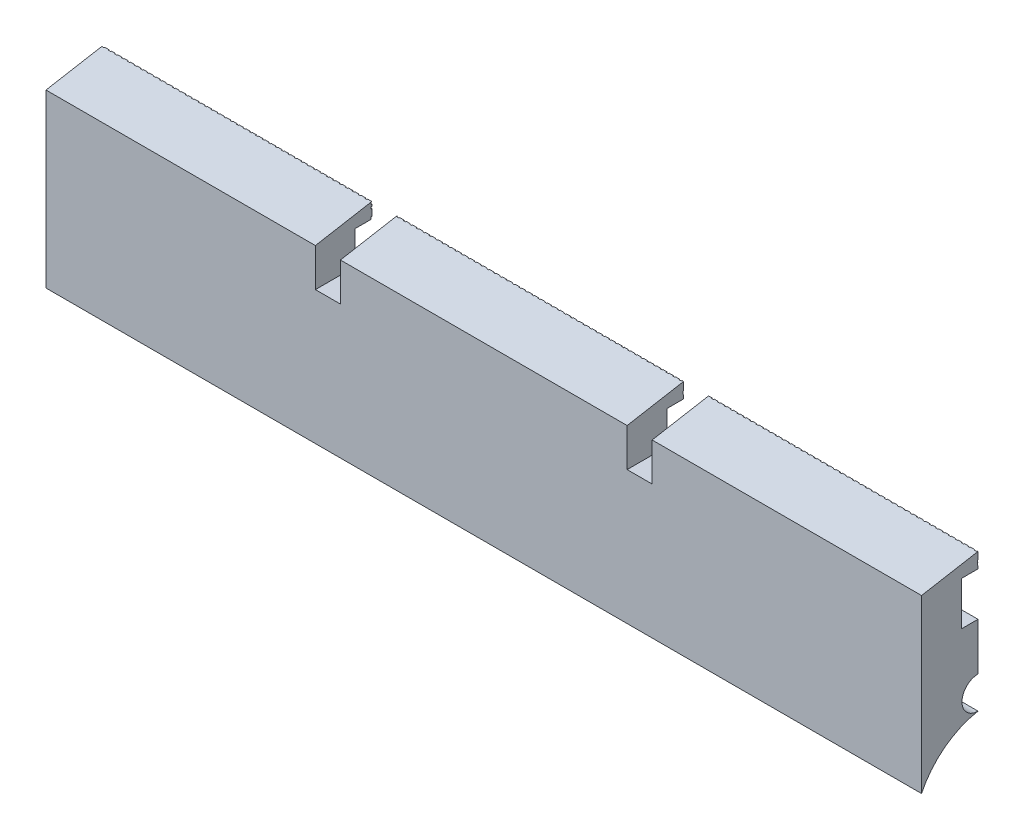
SolidWorks part; units mm, degrees
ref_plane "Plan de face" through (0, 0, 0) normal (0, 0, 1) x (1, 0, 0)
ref_plane "Plan de dessus" through (0, 0, 0) normal (0, 1, 0) x (1, 0, 0)
ref_plane "Plan de droite" through (0, 0, 0) normal (1, 0, 0) x (0, 0, -1)
imported_body "Importée1"
sketch "Esquisse1" plane through (-68.25, 0, 0) normal (-1, 0, 0) x (0, 0, 1)
  line L1 (0, 19.9908) -> (2.6, 19.9908)
  line L2 (0, 19.9908) -> (0, 13.1908)
  line L3 (0, 13.1908) -> (2.6, 13.1908)
  line L4 (2.6, 19.9908) -> (2.6, 13.1908)
  dimension "D1" = 2.6
  dimension "D2" = 6.8
extrude "rainure prismatique" cut sketch "Esquisse1" against normal through all
sketch "Esquisse2" plane through (-68.25, 0, 0) normal (-1, 0, 0) x (0, 0, 1)
  line L0 (0, 13.1908) -> (0, -20.55) construction
  line L1 (0, 0.7908) -> (0, 5.7908)
  arc A0 (0, 5.7908) -> (0, 0.7908) centre (0, 3.2908) cw
  dimension "D1" = 7.4
  dimension "D2" = 2.5
extrude "rainure cylindrique" cut sketch "Esquisse2" against normal through all
sketch "Esquisse3" plane through (-68.25, 0, 0) normal (-1, 0, 0) x (0, 0, 1)
  line L1 (8.8, 20.7983) -> (8.8, -16.55) construction
  line L2 (8.8, -5.9425) -> (8.8, -25.6853)
  line L3 (8.8, -25.6853) -> (0, -25.6853)
  line L4 (0, -25.6853) -> (0, 0.7908)
  arc A0 (0, 0.7908) -> (8.8, -5.9425) centre (-2.2, -11.2017) cw
  dimension "D1" = 11
  dimension "D2" = 32
extrude "MIP cas 1" cut sketch "Esquisse3" against normal through all
